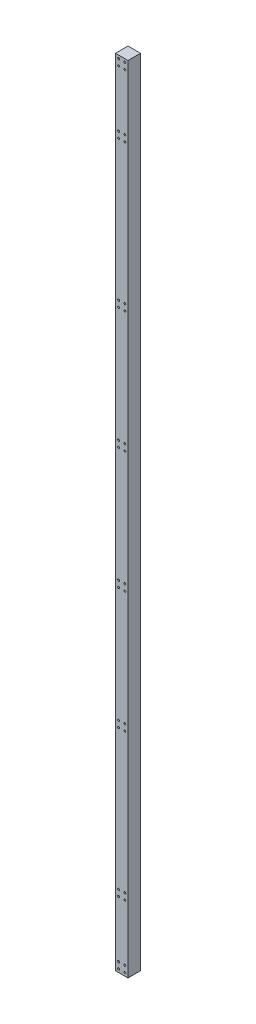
SolidWorks part; units mm, degrees
ref_plane "前视基准面" through (0, 0, 0) normal (0, 0, 1) x (1, 0, 0)
ref_plane "上视基准面" through (0, 0, 0) normal (0, 1, 0) x (1, 0, 0)
ref_plane "右视基准面" through (0, 0, 0) normal (1, 0, 0) x (0, 0, -1)
other "Configuration Table"
sketch "草图1" plane through (0, 0, 0) normal (0, 1, 0) x (1, 0, 0)
  line L1 (-30, 30) -> (30, 30)
  line L2 (-30, 30) -> (-30, -30)
  line L3 (-30, -30) -> (30, -30)
  line L4 (30, 30) -> (30, -30)
  line L5 (-30, 30) -> (30, -30) construction
  line L6 (-30, -30) -> (30, 30) construction
  point P0 (0, 0)
extrude "凸台-拉伸1" add sketch "草图1" along normal blind 3800
sketch "草图2" plane through (-30, 0, 0) normal (-1, 0, 0) x (0, 0, 1)
  line L0 (-30, 1030) -> (30, 1030)
  line L1 (-30, 3800) -> (-30, 0) construction
  line L2 (30, 3800) -> (30, 0) construction
  line L3 (-30, 1610) -> (30, 1610)
  line L4 (-30, 2190) -> (30, 2190)
  line L5 (-30, 1610) -> (30, 1610)
  line L6 (-30, 0) -> (30, 0) construction
  line L7 (-30, 2770) -> (30, 2770)
  line L9 (-30, 3800) -> (30, 3800) construction
  dimension "D1" = 1030
  dimension "D2" = 580
  dimension "D3" = 580
  dimension "D4" = 580
  dimension "D5" = 1030
sketch "草图3" plane through (0, 0, -30) normal (0, 0, -1) x (-1, 0, 0)
  line L0 (30, 3800) -> (30, 0) construction
  line L1 (-30, 0) -> (30, 0) construction
  point P0 (15, 1015)
  point P5 (15, 1595)
  point P6 (15, 2175)
  point P7 (15, 2755)
  point P8 (-15, 1015)
  point P9 (-15, 1045)
  point P10 (15, 1045)
  point P11 (15, 2755)
  point P12 (-15, 1595)
  point P13 (-15, 1625)
  point P14 (15, 1625)
  point P15 (-15, 2175)
  point P16 (-15, 2205)
  point P17 (15, 2205)
  point P18 (15, 2175)
  point P19 (0, 0)
  point P20 (-15, 2755)
  point P21 (-15, 2785)
  point P22 (0, 0)
  point P23 (15, 2785)
  point P24 (0, 0)
  point P25 (0, 0)
  dimension "D1" = 15
  dimension "D2" = 1015
  dimension "D5" = 580
  dimension "D8" = 580
  dimension "D9" = 2
  dimension "D11" = 580
  dimension "D10" = 2
  dimension "D3" = 2
  dimension "D4" = 2
  dimension "D6" = 2
  dimension "D7" = 2
  dimension "D12" = 2
  dimension "D13" = 2
hole_wizard "M8 内六角花型圆柱头螺钉的柱形沉头孔1" positions "草图4" profile "草图5" counterbore size "M8" standard "GB"
sketch "草图4" plane through (0, 0, -30) normal (0, 0, -1) x (-1, 0, 0)
  line L0 (-30, 0) -> (30, 0) construction
  line L1 (-30, 3800) -> (30, 3800) construction
  line L2 (-30, 3800) -> (-30, 0) construction
  point P0 (15, 1015)
  point P3 (-15, 1015)
  point P6 (-15, 1045)
  point P9 (15, 1045)
  point P12 (15, 1595)
  point P15 (-15, 1595)
  point P18 (-15, 1625)
  point P21 (15, 1625)
  point P24 (15, 2175)
  point P27 (-15, 2175)
  point P30 (-15, 2205)
  point P33 (15, 2205)
  point P36 (15, 2755)
  point P39 (-15, 2755)
  point P42 (-15, 2785)
  point P45 (15, 2785)
  point P48 (-15, 15)
  point P50 (-15, 45)
  point P52 (15, 45)
  point P54 (15, 15)
  point P67 (-15, 315)
  point P69 (15, 315)
  point P74 (-15, 345)
  point P76 (15, 345)
  point P79 (-15, 3785)
  point P92 (15, 3785)
  point P93 (15, 3755)
  point P97 (-15, 3755)
  point P99 (-15, 3485)
  point P102 (15, 3485)
  point P104 (-15, 3455)
  point P107 (15, 3455)
  dimension "D1" = 15
  dimension "D2" = 15
  dimension "D3" = 30
  dimension "D4" = 30
  dimension "D5" = 315
  dimension "D6" = 315
  dimension "D7" = 30
  dimension "D8" = 15
  dimension "D9" = 15
  dimension "D10" = 30
  dimension "D11" = 15
  dimension "D12" = 315
  dimension "D13" = 30
sketch "草图5" plane through (-15, 1015, -30) normal (1, 0, 0) x (0, 1, 0)
  line L0 (0, 0) -> (0, 60)
  line L1 (0, 60) -> (4.5, 60)
  line L3 (4.5, 60) -> (4.5, 6)
  line L4 (4.5, 6) -> (7.5, 6)
  line L5 (7.5, 6) -> (7.5, 0)
  line L7 (7.5, 0) -> (0, 0)
  line L11 (0, -6.35) -> (0, 107.95) construction
  dimension "通孔孔直径" = 9
  dimension "通孔孔深度" = 60
  dimension "柱形沉头孔直径" = 15
  dimension "柱形沉头孔深度" = 6
